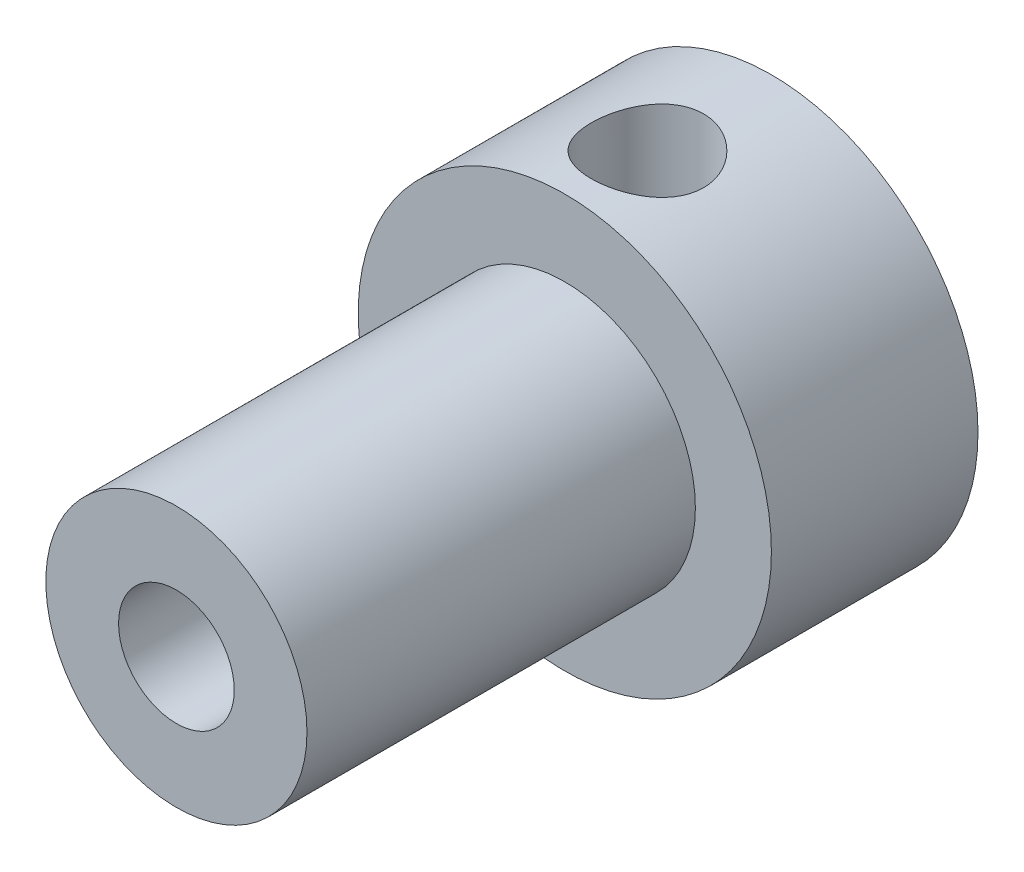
SolidWorks part; units mm, degrees
ref_plane "Front Plane" through (0, 0, 0) normal (0, 0, 1) x (1, 0, 0)
ref_plane "Top Plane" through (0, 0, 0) normal (0, 1, 0) x (1, 0, 0)
ref_plane "Right Plane" through (0, 0, 0) normal (1, 0, 0) x (0, 0, -1)
sketch "Sketch1" plane through (0, 0, 0) normal (0, 0, 1) x (1, 0, 0)
  circle A0 centre (0, 0) radius 6.35
  circle A1 centre (0, 0) radius 1.778
  dimension "D1" = 12.7
  dimension "D2" = 3.556
extrude "Extrude1" add sketch "Sketch1" along normal blind 18.288
sketch "Sketch2" plane through (0, 0, 18.288) normal (0, 0, 1) x (1, 0, 0)
  circle A0 centre (0, 0) radius 6.35
  circle A1 centre (0, 0) radius 4.0132
  dimension "D1" = 8.0264
  dimension "D2" = 12.7
extrude "Extrude2" cut sketch "Sketch2" against normal blind 11.938
hole_wizard "#8-32 Tapped Hole1" positions "3DSketch1" profile "Sketch3" tap size "#8-32" standard "Ansi Inch"
sketch3d "3DSketch1"
  point P0 (0, 6.35, 3.81)
  dimension "D1" = 3.81
sketch "Sketch3" plane through (0, 6.35, 3.81) normal (1, 0, 0) x (0, 0, 1)
  line L0 (0, 0) -> (0, 4.572)
  line L1 (0, 4.572) -> (1.7272, 4.572)
  line L2 (1.7272, 4.572) -> (1.7272, 0)
  line L5 (1.7272, 0) -> (0, 0)
  line L11 (0, -6.35) -> (0, 107.95) construction
  dimension "Thru Tap Drill Dia." = 3.4544
  dimension "Thru Tap Drill Depth" = 4.572
sketch "Sketch4" plane through (0, 0, 0) normal (0, 0, -1) x (-1, 0, 0)
  circle A0 centre (0, 0) radius 2.0002
  dimension "D1" = 4.0005
extrude "Extrude3" cut sketch "Sketch4" against normal blind 10.668
